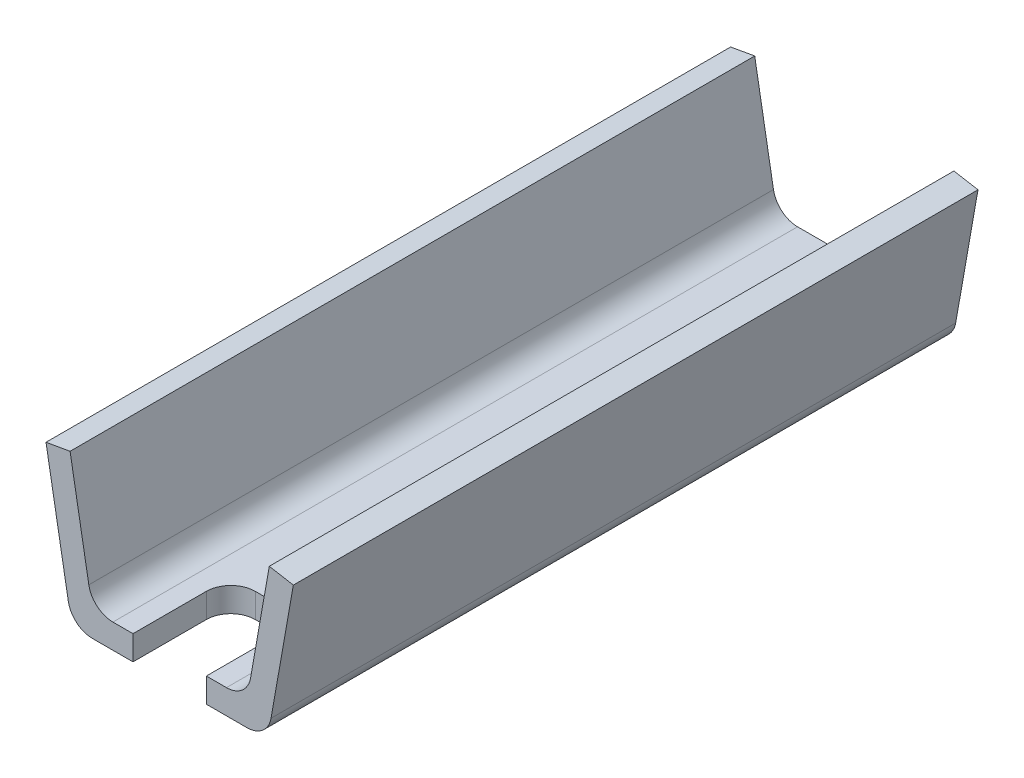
SolidWorks part; units mm, degrees
ref_plane "前视基准面" through (0, 0, 0) normal (0, 0, 1) x (1, 0, 0)
ref_plane "上视基准面" through (0, 0, 0) normal (0, 1, 0) x (1, 0, 0)
ref_plane "右视基准面" through (0, 0, 0) normal (1, 0, 0) x (0, 0, -1)
sketch "草图1" plane through (0, 0, 0) normal (0, 0, 1) x (1, 0, 0)
  line L0 (-15.8045, 0) -> (15.8045, 0)
  line L1 (20.7285, 4.1318) -> (25.2898, 30)
  line L2 (25.2898, 30) -> (20.3658, 30.8682)
  line L3 (20.3658, 30.8682) -> (16.533, 9.1318)
  line L4 (11.609, 5) -> (-11.609, 5)
  line L5 (-16.533, 9.1318) -> (-20.3658, 30.8682)
  line L6 (-20.3658, 30.8682) -> (-25.2898, 30)
  line L7 (-25.2898, 30) -> (-20.7285, 4.1318)
  arc A0 (-11.609, 5) -> (-16.533, 9.1318) centre (-11.609, 10) cw
  arc A1 (16.533, 9.1318) -> (11.609, 5) centre (11.609, 10) cw
  arc A2 (15.8045, 0) -> (20.7285, 4.1318) centre (15.8045, 5) ccw
  arc A3 (-15.8045, 0) -> (-20.7285, 4.1318) centre (-15.8045, 5) cw
  point P15 (20, 0)
  point P18 (-20, 0)
  dimension "D10" = 5
  dimension "D1" = 5
  dimension "D2" = 30
  dimension "D3" = 5
  dimension "D4" = 5
  dimension "D5" = 30
  dimension "D6" = 40
  dimension "D7" = 20
  dimension "D8" = 100
  dimension "D9" = 100
extrude "拉伸1" add sketch "草图1" along normal blind 140
sketch "草图2" plane through (0, 0, 140) normal (0, 0, 1) x (1, 0, 0)
  line L1 (-7.5, 7.3831) -> (7.5, 7.3831)
  line L2 (-7.5, 7.3831) -> (-7.5, -3.7177)
  line L3 (-7.5, -3.7177) -> (7.5, -3.7177)
  line L4 (7.5, 7.3831) -> (7.5, -3.7177)
  dimension "D1" = 15
  dimension "D2" = 7.5
extrude "切除-拉伸1" cut sketch "草图2" against normal blind 20
fillet "圆角1" radius 5 2 edges at (7.5, 2.5, 120) (-7.5, 2.5, 120)
